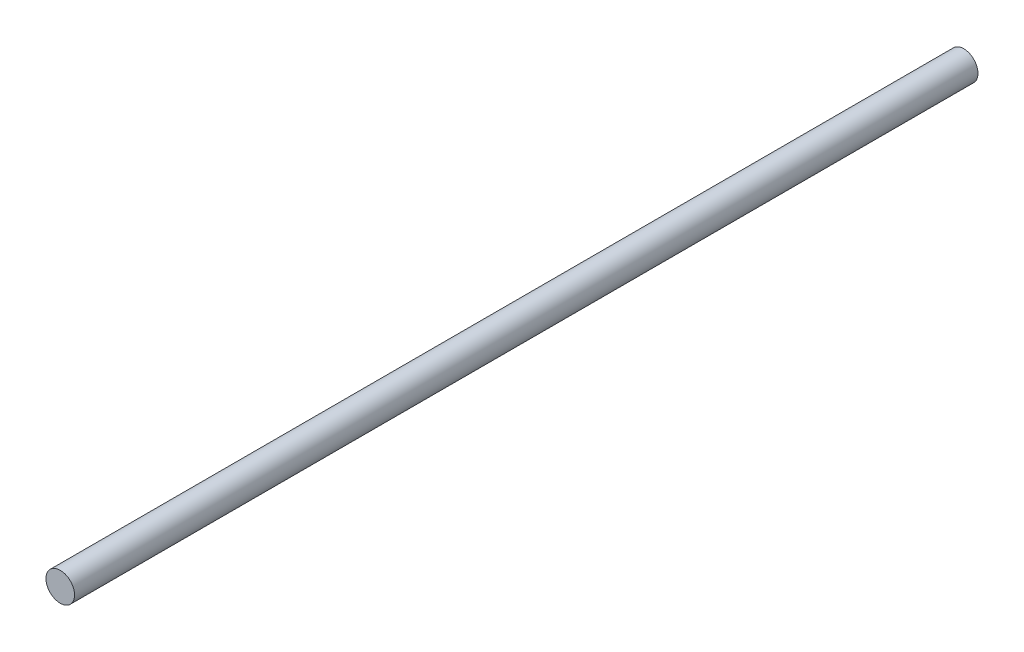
SolidWorks part; units mm, degrees
ref_plane "Front Plane" through (0, 0, 0) normal (0, 0, 1) x (1, 0, 0)
ref_plane "Top Plane" through (0, 0, 0) normal (0, 1, 0) x (1, 0, 0)
ref_plane "Right Plane" through (0, 0, 0) normal (1, 0, 0) x (0, 0, -1)
sketch "Sketch1" plane through (0, 0, 0) normal (0, 0, 1) x (1, 0, 0)
  circle A0 centre (0, 0) radius 6.35
  dimension "D1" = 12.7
extrude "Boss-Extrude1" add sketch "Sketch1" along normal blind 401.574
sketch "Sketch2" plane through (0, 0, 0) normal (0, 1, 0) x (1, 0, 0)
  line L0 (6.35, 0) -> (-6.35, 0) construction
  line L1 (-2.8592, 0) -> (2.5112, 0)
  line L2 (-2.8592, 0) -> (-2.8592, -9.7393)
  line L3 (-2.8592, -9.7393) -> (2.5112, -9.7393)
  line L4 (2.5112, 0) -> (2.5112, -9.7393)
ref_plane "Plane1" through (0, 0, 200.787) normal (0, 0, 1) x (1, 0, 0)
